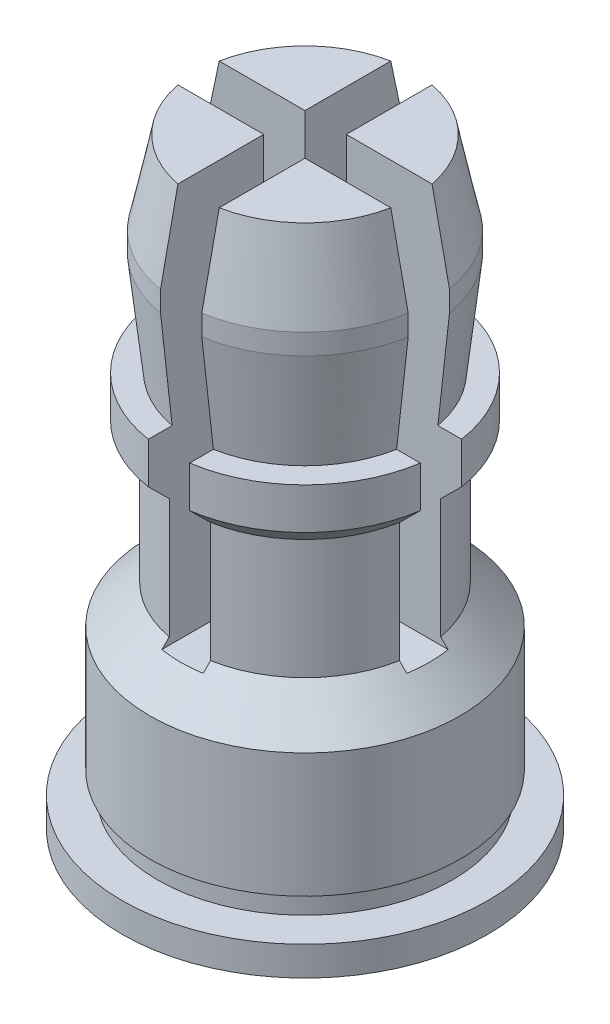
SolidWorks part; units mm, degrees
ref_plane "Plane1" through (0, 0, 0) normal (0, 0, 1) x (1, 0, 0)
ref_plane "Plane2" through (0, 0, 0) normal (0, 1, 0) x (1, 0, 0)
ref_plane "Plane3" through (0, 0, 0) normal (1, 0, 0) x (0, 0, -1)
sketch "BodySke" plane through (0, 0, 0) normal (0, 0, 1) x (1, 0, 0)
  line L0 (2.5578, 0.508) -> (2.5578, 0.889)
  line L1 (2.6924, 3.0434) -> (2.0295, 3.7064)
  line L3 (2.0295, 3.7064) -> (2.0295, 5.7836)
  line L4 (0, 0) -> (3.175, 0)
  line L5 (3.175, 0) -> (3.175, 0.508)
  line L6 (3.175, 0.508) -> (2.5578, 0.508)
  line L7 (2.3876, 6.1417) -> (2.3876, 6.858)
  line L8 (2.6924, 0.889) -> (2.6924, 3.0434)
  line L9 (0, 0) -> (0, 17.145) construction
  line L10 (2.3876, 6.858) -> (1.9812, 6.858)
  line L11 (1.9812, 6.858) -> (2.1793, 8.6487)
  line L12 (2.1793, 8.6487) -> (2.1793, 9.0068)
  line L13 (2.1793, 9.0068) -> (1.8821, 10.4394)
  line L14 (1.8821, 10.4394) -> (0, 10.4394)
  line L15 (2.5578, 0.889) -> (2.6924, 0.889)
  line L17 (0, 10.4394) -> (0, 0)
  line L19 (2.3876, 6.1417) -> (2.0295, 5.7836)
  dimension "D1" = 315
  dimension "H_dia" = 6.35
  dimension "T_ht" = 0.508
  dimension "C_dia" = 5.3848
  dimension "Groove_dia" = 5.1156
  dimension "Groove_wid" = 0.381
  dimension "Length" = 6.858
  dimension "D_ht" = 3.5814
  dimension "Neck_dia" = 4.0589
  dimension "B_dia" = 4.7752
  dimension "B_ht" = 0.7163
  dimension "Panel_dia" = 3.9624
  dimension "Slip_dia" = 4.3586
  dimension "Tip_dia" = 3.7643
  dimension "Grip_ht" = 1.7907
  dimension "Slip_ht" = 0.3581
  dimension "Neck_len" = 3.1516
revolve "Body" add sketch "BodySke" angle 360 about L9
sketch "SlitCutSke" plane through (0, 10.4394, 0) normal (0, 1, 0) x (-1, 0, 0)
  line L0 (-2.6685, 0.3581) -> (2.6685, 0.3581)
  line L1 (2.6685, -0.3581) -> (-2.6685, -0.3581)
  line L2 (-2.6685, 0.3581) -> (-2.6685, -0.3581)
  line L3 (2.6685, 0.3581) -> (2.6685, -0.3581)
  line L4 (-4.064, 0) -> (4.064, 0) construction
  circle A1 centre (0, 0) radius 2.6924 construction
  dimension "Width" = 0.7163
extrude "SlitCut" cut sketch "SlitCutSke" against normal blind 6.86
pattern_circular "SlitCutPat" count 2 every 90 about axis through (0, 0, 0) along (0, 1, 0) of "SlitCut"
ref_plane "Plane4" through (0, -0.5486, 0) normal (0, 1, 0) x (-1, 0, 0)
equation "' \"Panel_dia@BodySke\" = 0.156"
equation "' \"Length@BodySke\" = 0.25"
equation "' \"B_dia@BodySke\" = 0.188"
equation "' \"C_dia@BodySke\" = 0.212"
equation "' \"D_ht@BodySke\" = 0.141"
equation "' \"H_dia@BodySke\" = 0.25"
equation "' \"T_ht@BodySke\" = 0.02"
equation "\"Tip_dia@BodySke\" = \"Panel_dia@BodySke\" * 0.95"
equation "\"Slip_dia@BodySke\" = \"Panel_dia@BodySke\" * 1.1"
equation "\"Slip_ht@BodySke\" = \"D_ht@BodySke\" * 0.1"
equation "\"Grip_ht@BodySke\" = \"D_ht@BodySke\" * 0.5"
equation "\"B_ht@BodySke\" = \"B_dia@BodySke\" * 0.15"
equation "\"Neck_dia@BodySke\" = \"B_dia@BodySke\" * 0.85"
equation "\"Neck_len@BodySke\" = \"B_dia@BodySke\" * 0.66"
equation "\"Groove_dia@BodySke\" = \"C_dia@BodySke\" * 0.95"
equation "\"Groove_wid@BodySke\" = \"T_ht@BodySke\" * 0.75"
equation "\"Width@SlitCutSke\" = \"B_ht@BodySke\""
equation "\"Depth@SlitCut\" = \"D_ht@BodySke\" + \"Neck_len@BodySke\" + 0.005"
